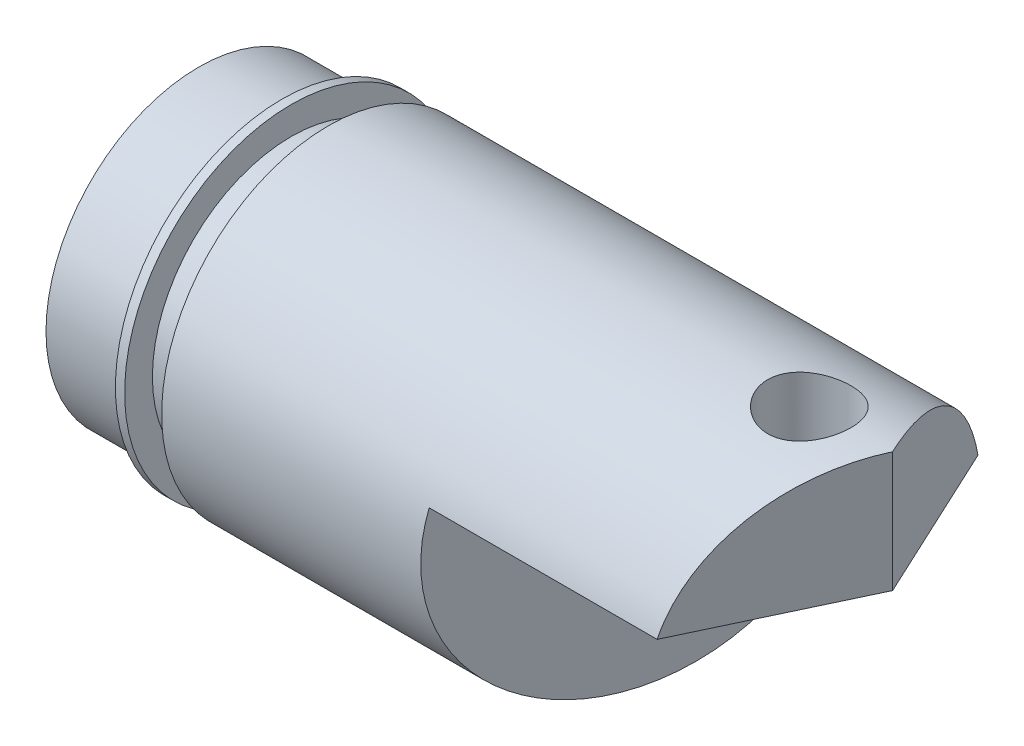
SolidWorks part; units mm, degrees
ref_plane "Plan de face" through (0, 0, 0) normal (0, 0, 1) x (1, 0, 0)
ref_plane "Plan de dessus" through (0, 0, 0) normal (0, 1, 0) x (1, 0, 0)
ref_plane "Plan de droite" through (0, 0, 0) normal (1, 0, 0) x (0, 0, -1)
sketch "Esquisse6" plane through (0, 0, 0) normal (0, 0, 1) x (1, 0, 0)
  line L0 (0, 21) -> (0, 33)
  line L1 (0, 33) -> (18, 33)
  line L2 (18, 33) -> (18, 36)
  line L3 (18, 36) -> (20, 36)
  line L4 (20, 36) -> (20, 30)
  line L5 (20, 30) -> (28, 30)
  line L6 (28, 30) -> (28, 36)
  line L7 (28, 36) -> (150, 36)
  line L8 (150, 36) -> (150, 0)
  line L9 (150, 0) -> (81, 0)
  line L10 (67.9217, 14.8764) -> (36, 19)
  line L11 (36, 19) -> (36, 21)
  line L12 (36, 21) -> (0, 21)
  arc A0 (81, 0) -> (67.9217, 14.8764) centre (66, 0) ccw
revolve "Révolution1" add sketch "Esquisse6" angle 360 about L9
ref_plane "Plan4" through (0, 10, 0) normal (0, 1, 0) x (-1, 0, 0)
sketch "Esquisse7" plane through (0, 10, 0) normal (0, 1, 0) x (1, 0, 0)
  line L0 (105, 36) -> (84, -36)
  line L1 (84, -36) -> (150, -36)
  line L2 (150, -36) -> (150, 36)
  line L3 (150, 36) -> (105, 36)
extrude "Enlèv. mat.-Extru.3" cut sketch "Esquisse7" against normal through all
sketch "Esquisse8" plane through (0, 10, 0) normal (0, 1, 0) x (-1, 0, 0)
  line L0 (-130.289, -42.2704) -> (-160.6635, -42.2704)
  line L1 (-160.6635, -42.2704) -> (-160.6635, 48.4838)
  line L2 (-160.6635, 48.4838) -> (-127.1253, 48.4838)
  line L3 (-127.1253, 48.4838) -> (-150, 0)
  line L4 (-150, 0) -> (-130.289, -42.2704)
  circle A0 centre (-132, 0) radius 9
extrude "Enlèv. mat.-Extru.4" cut sketch "Esquisse8" along normal through all
